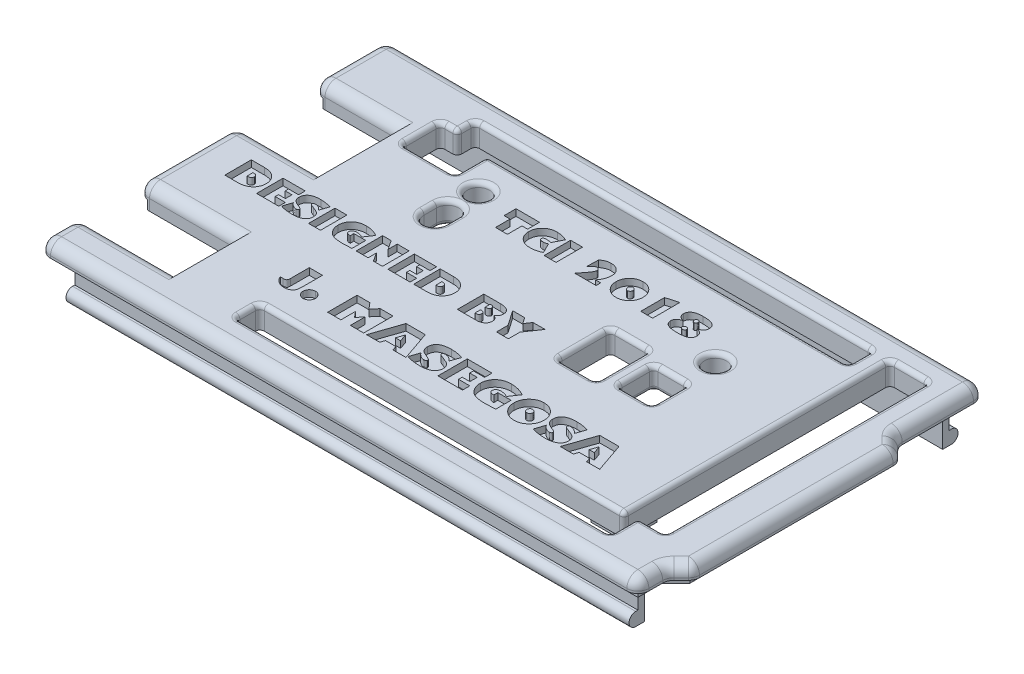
SolidWorks part; units mm, degrees
ref_plane "Front Plane" through (0, 0, 0) normal (0, 0, 1) x (1, 0, 0)
ref_plane "Top Plane" through (0, 0, 0) normal (0, 1, 0) x (1, 0, 0)
ref_plane "Right Plane" through (0, 0, 0) normal (1, 0, 0) x (0, 0, -1)
sketch "Sketch1" plane through (0, 0, 0) normal (0, 1, 0) x (1, 0, 0)
  line L0 (68.9411, 25.2731) -> (68.9411, 12.3231)
  line L1 (68.9411, 12.3231) -> (71.4811, 9.7831)
  line L2 (71.4811, 9.7831) -> (71.4811, -22.9869)
  line L3 (71.4811, -22.9869) -> (68.9411, -25.5269)
  line L4 (68.9411, -25.5269) -> (68.9411, -28.0669)
  line L5 (68.9411, 25.2731) -> (-30.1189, 25.2731)
  line L6 (-30.1189, 25.2731) -> (-30.1189, -28.0669)
  line L7 (-30.1189, -28.0669) -> (68.9411, -28.0669)
  line L8 (-32.5189, 27.6731) -> (71.3411, 27.6731)
  line L9 (71.3411, 27.6731) -> (71.3411, 13.3172)
  line L10 (71.3411, 13.3172) -> (73.8811, 10.7772)
  line L11 (73.8811, 10.7772) -> (73.8811, -23.9811)
  line L12 (73.8811, -23.9811) -> (71.3411, -26.5211)
  line L13 (71.3411, -26.5211) -> (71.3411, -30.4669)
  line L14 (71.3411, -30.4669) -> (-32.5189, -30.4669)
  line L15 (-32.5189, -30.4669) -> (-32.5189, 27.6731)
  line L16 (73.7411, 30.0731) -> (73.7411, 14.3113)
  line L17 (-34.9189, 30.0731) -> (73.7411, 30.0731)
  line L18 (-34.9189, 30.0731) -> (-34.9189, -32.8669)
  line L19 (-34.9189, -32.8669) -> (73.7411, -32.8669)
  line L21 (73.7411, 14.3113) -> (76.2465, 11.8059)
  line L22 (76.2465, 11.8059) -> (76.2465, -25.0098)
  line L23 (76.2465, -25.0098) -> (73.7411, -27.5152)
  line L24 (73.7411, -27.5152) -> (73.7411, -32.8669)
extrude "Boss-Extrude4" add sketch "Sketch1" along normal blind 4 contours L18 L19 L24 L23 L22 L21 L16 L17
sketch "Sketch5" plane through (0, 0, 0) normal (0, -1, 0) x (1, 0, 0)
  line L1 (-33.3189, 31.2669) -> (72.1411, 31.2669)
  line L2 (-33.3189, 31.2669) -> (-33.3189, -28.4731)
  line L3 (-33.3189, -28.4731) -> (72.1411, -28.4731)
  line L10 (-34.9189, -30.0731) -> (-34.9189, 32.8669) construction
  line L12 (72.1411, 31.2669) -> (72.1411, 26.8524)
  line L13 (72.1411, 26.8524) -> (74.6465, 24.347)
  line L14 (74.6465, 24.347) -> (74.6465, -11.1432)
  line L15 (74.6465, -11.1432) -> (72.1411, -13.6485)
  line L16 (72.1411, -13.6485) -> (72.1411, -28.4731)
  line L18 (73.7411, -30.0731) -> (73.7411, -14.3113) construction
  line L19 (76.2465, -11.8059) -> (76.2465, 25.0098) construction
  line L21 (73.7411, 27.5152) -> (73.7411, 32.8669) construction
  line L24 (73.7411, -14.3113) -> (76.2465, -11.8059) construction
  line L25 (76.2465, 25.0098) -> (73.7411, 27.5152) construction
  line L28 (-34.9189, 32.8669) -> (73.7411, 32.8669) construction
  line L29 (-34.9189, -30.0731) -> (73.7411, -30.0731) construction
extrude "Cut-Extrude1" cut sketch "Sketch5" against normal blind 1.6 contours L15 L16 L3 L2 L1 L12 L13 L14 M16 M9 M10 M11 M12 M13 M14 M15
fillet "Fillet1" radius 2 8 edges at (-34.9189, 2.8, 32.8669) (-34.9189, 2.8, -30.0731) (73.7411, 2.8, -14.3113) (73.7411, 2.8, -30.0731) (76.2465, 2.8, -11.8059) (76.2465, 2.8, 25.0098) (73.7411, 2.8, 27.5152) (73.7411, 2.8, 32.8669)
sketch "Sketch6" plane through (0, 4, 0) normal (0, 1, 0) x (1, 0, 0)
  line L0 (-30.1189, 25.2731) -> (-30.1189, -28.0669) construction
  line L1 (-13.5889, 24.9331) -> (58.5111, 24.9331)
  line L2 (-13.5889, 24.9331) -> (-13.5889, 21.6631)
  line L3 (-7.0189, 20.5231) -> (58.5111, 20.5231)
  line L4 (58.5111, 24.9331) -> (58.5111, 20.5231)
  line L5 (61.6511, 25.0031) -> (68.6011, 25.0031)
  line L6 (61.6511, 25.0031) -> (61.6511, -22.7169)
  line L7 (63.5911, -22.7169) -> (68.6011, -22.7169)
  line L8 (68.6011, 25.0031) -> (68.6011, -22.7169)
  line L9 (63.5911, -27.7269) -> (-4.4489, -27.7269)
  line L10 (63.5911, -27.7269) -> (63.5911, -23.3169)
  line L11 (61.6511, -23.3169) -> (-4.4489, -23.3169)
  line L12 (-4.4489, -27.7269) -> (-4.4489, -23.3169)
  line L14 (68.9411, -25.5269) -> (68.9411, -28.0669) construction
  line L16 (-30.1189, -28.0669) -> (68.9411, -28.0669) construction
  line L17 (71.4811, 9.7831) -> (71.4811, -22.9869) construction
  line L18 (68.9411, 25.2731) -> (-30.1189, 25.2731) construction
  line L19 (68.9411, 25.2731) -> (68.9411, 12.3231) construction
  line L20 (-34.9189, 30.0731) -> (-34.9189, -32.8669) construction
  line L21 (-34.9189, -25.8869) -> (-16.4189, -25.8869)
  line L22 (-34.9189, -25.8869) -> (-34.9189, -14.8869)
  line L23 (-34.9189, -14.8869) -> (-16.4189, -14.8869)
  line L24 (-16.4189, -25.8869) -> (-16.4189, -14.8869)
  line L25 (61.6511, -22.7169) -> (61.6511, -23.3169)
  line L26 (-34.9189, 2.9331) -> (-18.9689, 2.9331)
  line L27 (-34.9189, 2.9331) -> (-34.9189, 16.9731)
  line L28 (-34.9189, 16.9731) -> (-18.9689, 16.9731)
  line L29 (-18.9689, 2.9331) -> (-18.9689, 16.9731)
  line L30 (63.5911, -23.3169) -> (63.5911, -22.7169)
  line L31 (-4.1789, 8.5031) -> (-4.1789, 6.2131)
  line L32 (-16.6389, 21.6631) -> (-13.5889, 21.6631)
  line L33 (-16.6389, 21.6631) -> (-16.6389, 14.6631)
  line L34 (-16.6389, 14.6631) -> (-7.0189, 14.6631)
  line L35 (-7.0189, 20.5231) -> (-7.0189, 14.6631)
  line L36 (31.2911, 4.6331) -> (38.2911, 4.6331)
  line L37 (31.2911, 4.6331) -> (31.2911, -4.9869)
  line L38 (31.2911, -4.9869) -> (38.2911, -4.9869)
  line L39 (38.2911, 4.6331) -> (38.2911, -4.9869)
  line L40 (-0.1789, 8.5031) -> (-0.1789, 6.2131)
  line L42 (47.1311, 2.8231) -> (40.9311, 2.8231)
  line L43 (47.1311, 2.8231) -> (47.1311, -3.7269)
  line L44 (47.1311, -3.7269) -> (40.9311, -3.7269)
  line L45 (40.9311, 2.8231) -> (40.9311, -3.7269)
  circle A0 centre (-2.1789, 14.0931) radius 2
  arc A1 (-0.1789, 8.5031) -> (-4.1789, 8.5031) centre (-2.1789, 8.5031) ccw
  arc A2 (-4.1789, 6.2131) -> (-0.1789, 6.2131) centre (-2.1789, 6.2131) ccw
  circle A3 centre (46.1811, 8.7631) radius 2
  point P14 (-4.4489, -25.5219)
  point P25 (-13.5889, 23.2981)
extrude "Cut-Extrude2" cut sketch "Sketch6" against normal blind 4
fillet "Fillet2" radius 2 4 edges at (-34.9189, 2.8, 25.8869) (-34.9189, 2.8, 14.8869) (-34.9189, 2.8, -2.9331) (-34.9189, 2.8, -16.9731)
fillet "Fillet3" radius 0.8 40 edges at (58.5111, 2, -24.9331) (58.5111, 4, -22.7281) (58.5111, 2, -20.5231) (25.7461, 4, -20.5231) (-7.0189, 2, -20.5231) (-7.0189, 4, -17.5931) (-7.0189, 2, -14.6631) (-11.8289, 4, -14.6631) (-16.6389, 2, -14.6631) (22.4611, 4, -24.9331) (-13.5889, 2, -24.9331) (-16.6389, 4, -18.1631) (-16.6389, 2, -21.6631) (-15.1139, 4, -21.6631) (-13.5889, 4, -23.2981) (-13.5889, 2, -21.6631) (68.6011, 2, -25.0031) (61.6511, 2, -25.0031) (65.1261, 4, -25.0031) (61.6511, 4, -0.8431) (61.6511, 2, 23.3169) (68.6011, 2, 22.7169) (68.6011, 4, -1.1431) (66.0961, 4, 22.7169) (63.5911, 4, 25.2219) (63.5911, 2, 22.7169) (63.5911, 2, 27.7269) (29.5711, 4, 27.7269) (-4.4489, 2, 27.7269) (-4.4489, 4, 25.5219) (28.6011, 4, 23.3169) (-4.4489, 2, 23.3169) (31.2911, 2, 4.9869) (38.2911, 2, 4.9869) (38.2911, 2, -4.6331) (31.2911, 2, -4.6331) (34.7911, 4, 4.9869) (38.2911, 4, 0.1769) (34.7911, 4, -4.6331) (31.2911, 4, 0.1769)
fillet "Fillet4" radius 0.8 24 edges at (40.9311, 2, 3.7269) (44.0311, 0, 3.7269) (47.1311, 2, 3.7269) (44.0311, 4, 3.7269) (47.1311, 0, 0.4519) (47.1311, 4, 0.4519) (47.1311, 2, -2.8231) (40.9311, 0, 0.4519) (40.9311, 2, -2.8231) (40.9311, 4, 0.4519) (44.0311, 4, -2.8231) (44.0311, 0, -2.8231) (46.1811, 4, -6.7631) (46.1811, 0, -6.7631) (-4.1789, 0, -7.3581) (-2.1789, 0, -4.2131) (-0.1789, 0, -7.3581) (-2.1789, 4, -4.2131) (-0.1789, 4, -7.3581) (-2.1789, 0, -10.5031) (-4.1789, 4, -7.3581) (-2.1789, 4, -10.5031) (-2.1789, 0, -12.0931) (-2.1789, 4, -12.0931)
sketch "Sketch7" plane through (0, 0, 0) normal (0, -1, 0) x (1, 0, 0)
  line L0 (71.3411, 30.4669) -> (-32.5189, 30.4669) construction
  line L1 (-31.7189, 29.6669) -> (70.5411, 29.6669)
  line L2 (-31.7189, 29.6669) -> (-31.7189, 28.4669)
  line L3 (-31.7189, 28.4669) -> (70.5411, 28.4669)
  line L4 (70.5411, 29.6669) -> (70.5411, 28.4669)
  line L9 (-31.7189, -25.6731) -> (70.5411, -25.6731)
  line L10 (-31.7189, -25.6731) -> (-31.7189, -26.8731)
  line L11 (-31.7189, -26.8731) -> (70.5411, -26.8731)
  line L12 (70.5411, -25.6731) -> (70.5411, -26.8731)
  line L13 (-32.5189, 30.4669) -> (-32.5189, -27.6731) construction
  line L14 (71.3411, 26.5211) -> (71.3411, 30.4669) construction
  line L20 (-32.5189, -27.6731) -> (71.3411, -27.6731) construction
  line L21 (71.3411, -27.6731) -> (71.3411, -13.3172) construction
extrude "Boss-Extrude5" add sketch "Sketch7" along normal blind 6
fillet "Fillet5" radius 1.6 2 edges at (19.4111, 0, 29.6669) (19.4111, 0, -26.8731)
sketch "Sketch8" plane through (0, 0, 29.6669) normal (0, 0, 1) x (1, 0, 0)
  line L0 (70.5411, -6) -> (70.5411, -1.6) construction
  line L1 (-31.7189, -6) -> (70.5411, -6)
  line L2 (-31.7189, -6) -> (-31.7189, -3.6)
  line L3 (-31.7189, -3.6) -> (70.5411, -3.6)
  line L4 (70.5411, -6) -> (70.5411, -3.6)
sketch "Sketch10" plane through (0, 0, -26.8731) normal (0, 0, -1) x (-1, 0, 0)
  line L0 (31.7189, -6) -> (31.7189, -1.6) construction
  line L4 (-70.5411, -6) -> (31.7189, -6)
  line L5 (-70.5411, -6) -> (-70.5411, -3.6)
  line L6 (-70.5411, -3.6) -> (31.7189, -3.6)
  line L7 (31.7189, -6) -> (31.7189, -3.6)
extrude "Boss-Extrude6" add sketch "Sketch8" along normal blind 0.4
extrude "Boss-Extrude7" add sketch "Sketch10" along normal blind 0.4
sketch "Sketch11" plane through (0, 0, 30.0669) normal (0, 0, 1) x (1, 0, 0)
  line L0 (-31.7189, -4.8) -> (70.5411, -4.8)
  line L1 (-31.7189, -3.6) -> (-31.7189, -6) construction
  line L2 (70.5411, -6) -> (70.5411, -3.6) construction
revolve "Revolve-Thin1" add sketch "Sketch11" angle 180 about L0
sketch "Sketch13" plane through (0, 0, -27.2731) normal (0, 0, -1) x (-1, 0, 0)
  line L0 (-70.5411, -4.8) -> (31.7189, -4.8)
  line L1 (-70.5411, -3.6) -> (-70.5411, -6) construction
  line L2 (31.7189, -6) -> (31.7189, -3.6) construction
revolve "Revolve-Thin3" add sketch "Sketch13" angle 180 about L0
sketch "Sketch14" plane through (0, 4, 0) normal (0, 1, 0) x (1, 0, 0)
  text T0 "TCI 2018  " font "Gill Sans Ultra Bold" height in points 18
  text T1 "DESIGNED BY" font "Gill Sans Ultra Bold" height in points 18
  text T2 "J. MASEGOSA" font "Gill Sans Ultra Bold" height in points 20
extrude "Cut-Extrude3" cut sketch "Sketch14" against normal blind 1.2
fillet "Fillet6" radius 2 26 edges at (-25.9439, 4, -2.9331) (-24.6689, 4, 14.8869) (-24.6689, 4, 25.8869) (-25.9439, 4, -16.9731) (-34.3331, 4, 14.3012) (-34.9189, 4, 5.9769) (-34.3331, 4, -2.3473) (-34.3331, 4, -17.5588) (-34.9189, 4, -23.5231) (-34.3331, 4, -29.4873) (19.4111, 4, -30.0731) (73.1553, 4, -29.4873) (73.7411, 4, -21.6064) (73.8934, 4, -14.3743) (74.9938, 4, -13.0586) (76.0943, 4, -11.7429) (76.2465, 4, 6.6019) (76.0943, 4, 24.9467) (74.9938, 4, 26.2625) (73.8934, 4, 27.5782) (73.7411, 4, 29.6053) (73.1553, 4, 32.2812) (19.4111, 4, 32.8669) (-34.3331, 4, 32.2812) (-34.9189, 4, 29.3769) (-34.3331, 4, 26.4727)
sketch "Sketch15" plane through (0, 0, 0) normal (0, -1, 0) x (1, 0, 0)
  line L0 (60.8511, 23.3169) -> (-3.6489, 23.3169) construction
  line L1 (55.6511, 17.3169) -> (49.6511, 17.3169)
  line L2 (55.6511, 17.3169) -> (55.6511, 11.3169)
  line L3 (55.6511, 11.3169) -> (49.6511, 11.3169)
  line L4 (49.6511, 17.3169) -> (49.6511, 11.3169)
  line L5 (61.6511, -24.2031) -> (61.6511, 22.5169) construction
  line L6 (-6.2189, -20.5231) -> (57.7111, -20.5231) construction
  line L7 (5.8211, -14.5231) -> (11.8211, -14.5231)
  line L8 (5.8211, -14.5231) -> (5.8211, -8.5231)
  line L9 (5.8211, -8.5231) -> (11.8211, -8.5231)
  line L10 (11.8211, -14.5231) -> (11.8211, -8.5231)
  arc A0 (-2.3461, -11.2981) -> (-2.0116, -11.2981) centre (-2.1789, -14.0931) ccw construction
extrude "Boss-Extrude9" add sketch "Sketch15" along normal blind 6.4
fillet "Fillet7" radius 2 8 edges at (52.6511, 0, 17.3169) (49.6511, 0, 14.3169) (52.6511, 0, 11.3169) (55.6511, 0, 14.3169) (11.8211, 0, -11.5231) (8.8211, 0, -14.5231) (5.8211, 0, -11.5231) (8.8211, 0, -8.5231)
equation "\"Margen_seguridad\"= 2"
equation "\"Grosor_punta\"=0.4"
equation "\"Grosor_caja\"= 2.4"
equation "\"Encaje_lateral\"= \"Grosor_caja\" / 2"
equation "\"Altura_lateral\"= 1.6"
equation "\"Margen_conectores\"= 1.2"
equation "\"Altura_cierre\"= 5.2"
equation "\"Grosor_cierre\"=2.4"
equation "\"Profundidad_cierre\"= 1.2"
equation "\"Curvatura_exterior\"= 2"
equation "\"D17@Sketch1\"=\"Grosor_caja\""
equation "\"D18@Sketch1\"=\"Grosor_caja\""
equation "\"D23@Sketch1\"=\"Grosor_caja\""
equation "\"D19@Sketch1\"=\"Grosor_caja\""
equation "\"D21@Sketch1\"=\"Grosor_caja\""
equation "\"D22@Sketch1\"=\"Grosor_caja\""
equation "\"D20@Sketch1\"=\"Grosor_caja\""
equation "\"D12@Sketch1\"=\"Margen_seguridad\"+\"Grosor_punta\""
equation "\"D14@Sketch1\"=\"Margen_seguridad\"+\"Grosor_punta\""
equation "\"D16@Sketch1\"=\"Margen_seguridad\"+\"Grosor_punta\""
equation "\"D15@Sketch1\"=\"Margen_seguridad\"+\"Grosor_punta\""
equation "\"D11@Sketch1\"=\"Margen_seguridad\"+\"Grosor_punta\""
equation "\"D10@Sketch1\"=\"Margen_seguridad\"+\"Grosor_punta\""
equation "\"D13@Sketch1\"=\"Margen_seguridad\"+\"Grosor_punta\""
equation "\"D1@Boss-Extrude4\"=\"Grosor_caja\"+\"Altura_lateral\""
equation "\"D1@Sketch5\"=\"Grosor_caja\"/2+\"Grosor_punta\""
equation "\"D5@Sketch5\"=\"Grosor_caja\"/2+\"Grosor_punta\""
equation "\"D6@Sketch5\"=\"Grosor_caja\"/2+\"Grosor_punta\""
equation "\"D8@Sketch5\"=\"Grosor_caja\"/2+\"Grosor_punta\""
equation "\"D4@Sketch5\"=\"Grosor_caja\"/2+\"Grosor_punta\""
equation "\"D7@Sketch5\"=\"Grosor_caja\"/2+\"Grosor_punta\""
equation "\"D2@Sketch5\"=\"Grosor_caja\"/2+\"Grosor_punta\""
equation "\"D3@Sketch5\"=\"Grosor_caja\"/2+\"Grosor_punta\""
equation "\"D1@Sketch6\"=26.67 - \"Margen_seguridad\"/2"
equation "\"D2@Sketch6\" = 6.35 - \"Margen_seguridad\" / 2"
equation "\"D3@Sketch6\" = 1.34 - \"Margen_seguridad\" / 2"
equation "\"D4@Sketch6\" = 2.41 + \"Margen_seguridad\""
equation "\"D5@Sketch6\"=3.88-\"Margen_seguridad\"/2"
equation "\"D6@Sketch6\" = 6.35 - \"Margen_seguridad\" / 2"
equation "\"D7@Sketch6\"=4.95+\"Margen_seguridad\""
equation "\"D8@Sketch6\"=1.27-\"Margen_seguridad\"/2"
equation "\"D9@Sketch6\"=11.43-\"Margen_seguridad\"/2"
equation "\"D10@Sketch6\"=1.34-\"Margen_seguridad\"/2"
equation "\"D11@Sketch6\"=17.53-\"Margen_seguridad\"/2"
equation "\"D12@Sketch6\"=2.41+\"Margen_seguridad\""
equation "\"D1@Cut-Extrude2\"=\"Grosor_caja\"+\"Altura_lateral\""
equation "\"D13@Sketch6\"=3.18-\"Margen_seguridad\"/2"
equation "\"D14@Sketch6\"=9+\"Margen_seguridad\""
equation "\"D15@Sketch6\"=9.3-\"Margen_seguridad\"/2"
equation "\"D16@Sketch6\"=12.04+\"Margen_seguridad\""
equation "\"D17@Sketch6\"=12.7+\"Margen_seguridad\"/2"
equation "\"D18@Sketch6\"=10.15+\"Margen_seguridad\"/2"
equation "\"D1@Fillet2\"=\"Curvatura_exterior\""
equation "\"D19@Sketch6\"=14.48-\"Margen_seguridad\"/2"
equation "\"D20@Sketch6\"=4.61-\"Margen_seguridad\"/2"
equation "\"D21@Sketch6\"=5+\"Margen_seguridad\""
equation "\"D22@Sketch6\"=7.62+\"Margen_seguridad\""
equation "\"D23@Sketch6\"=24.08-\"Margen_seguridad\"/2"
equation "\"D24@Sketch6\"=34.19-\"Margen_seguridad\"/2"
equation "\"D25@Sketch6\"=5+\"Margen_seguridad\""
equation "\"D26@Sketch6\"=7.62+\"Margen_seguridad\""
equation "\"Curvatura_pines\"= 0.8"
equation "\"D1@Fillet3\"=\"Curvatura_pines\""
equation "\"D27@Sketch6\"=10.58+0.6"
equation "\"D28@Sketch6\"=4"
equation "\"D29@Sketch6\"=4.39+1.2"
equation "\"D30@Sketch6\"=4"
equation "\"D31@Sketch6\"=1.09+1.2"
equation "\"D32@Sketch6\"=4"
equation "\"D33@Sketch6\"=24.34"
equation "\"D35@Sketch6\"=6.2"
equation "\"D36@Sketch6\"=6.55"
equation "\"D37@Sketch6\"=15.91+0.6"
equation "\"D38@Sketch6\"=24.7+0.6"
equation "\"D39@Sketch6\"=4"
equation "\"Curvatura_botones\"= 0.8"
equation "\"D1@Sketch7\"=2*\"Grosor_punta\""
equation "\"D2@Sketch7\"=2*\"Grosor_punta\""
equation "\"D3@Sketch7\"=2*\"Grosor_punta\""
equation "\"D4@Sketch7\" = \"Margen_seguridad\" - 2 * \"Grosor_punta\""
equation "\"D9@Sketch7\"=2*\"Grosor_punta\""
equation "\"D10@Sketch7\"=2*\"Grosor_punta\""
equation "\"D11@Sketch7\"=\"Margen_seguridad\"-2*\"Grosor_punta\""
equation "\"D12@Sketch7\"=2*\"Grosor_punta\""
equation "\"D1@Boss-Extrude5\"=\"Altura_cierre\"-\"Altura_lateral\"+\"Grosor_cierre\""
equation "\"Curvatura_refuerzo\"= 1.6"
equation "\"D1@Sketch8\"=\"Grosor_cierre\""
equation "\"Altura_soporte\"= 6.4"
equation "\"D1@Fillet4\"=\"Curvatura_botones\""
equation "\"D1@Boss-Extrude6\"=\"Grosor_punta\""
equation "\"D1@Sketch10\"=\"Grosor_cierre\""
equation "\"D1@Boss-Extrude7\"=\"Grosor_punta\""
equation "\"D3@Revolve-Thin1\"=\"Grosor_cierre\"/2"
equation "\"D3@Revolve-Thin3\"=\"Grosor_cierre\"/2"
equation "\"D1@Cut-Extrude3\"=\"Grosor_caja\"/2"
equation "\"D1@Fillet6\"=\"Curvatura_exterior\""
equation "\"D1@Sketch15\"=6"
equation "\"D2@Sketch15\"=6"
equation "\"D3@Sketch15\"=6"
equation "\"D4@Sketch15\"=6"
equation "\"D5@Sketch15\"=6"
equation "\"D6@Sketch15\"=8"
equation "\"D7@Sketch15\"=6"
equation "\"D8@Sketch15\"=6"
equation "\"D1@Boss-Extrude9\"=\"Altura_soporte\""
equation "\"D1@Fillet7\"=\"Curvatura_exterior\""
equation "\"D34@Sketch6\"=24.35"
equation "\"D40@Sketch6\"=27.94"
